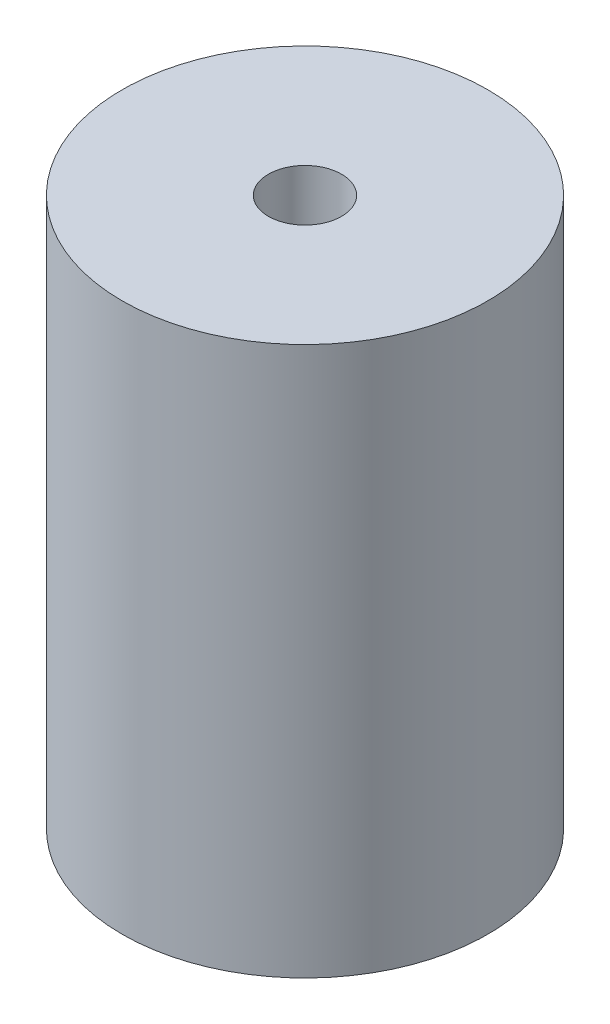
SolidWorks part; units mm, degrees
ref_plane "前视基准面" through (0, 0, 0) normal (0, 0, 1) x (1, 0, 0)
ref_plane "上视基准面" through (0, 0, 0) normal (0, 1, 0) x (1, 0, 0)
ref_plane "右视基准面" through (0, 0, 0) normal (1, 0, 0) x (0, 0, -1)
sketch "草图1" plane through (0, 0, 0) normal (0, 1, 0) x (1, 0, 0)
  circle A0 centre (0, 0) radius 10
  dimension "D1" = 20
extrude "凸台-拉伸1" add sketch "草图1" along normal blind 30
sketch "草图2" plane through (0, 30, 0) normal (0, 1, 0) x (1, 0, 0)
  circle A0 centre (0, 0) radius 2
  dimension "D1" = 4
extrude "切除-拉伸1" cut sketch "草图2" against normal blind 8
sketch "草图3" plane through (0, 0, 0) normal (0, -1, 0) x (1, 0, 0)
  circle A0 centre (0, 0) radius 4
  dimension "D1" = 8
extrude "切除-拉伸2" cut sketch "草图3" against normal blind 8
